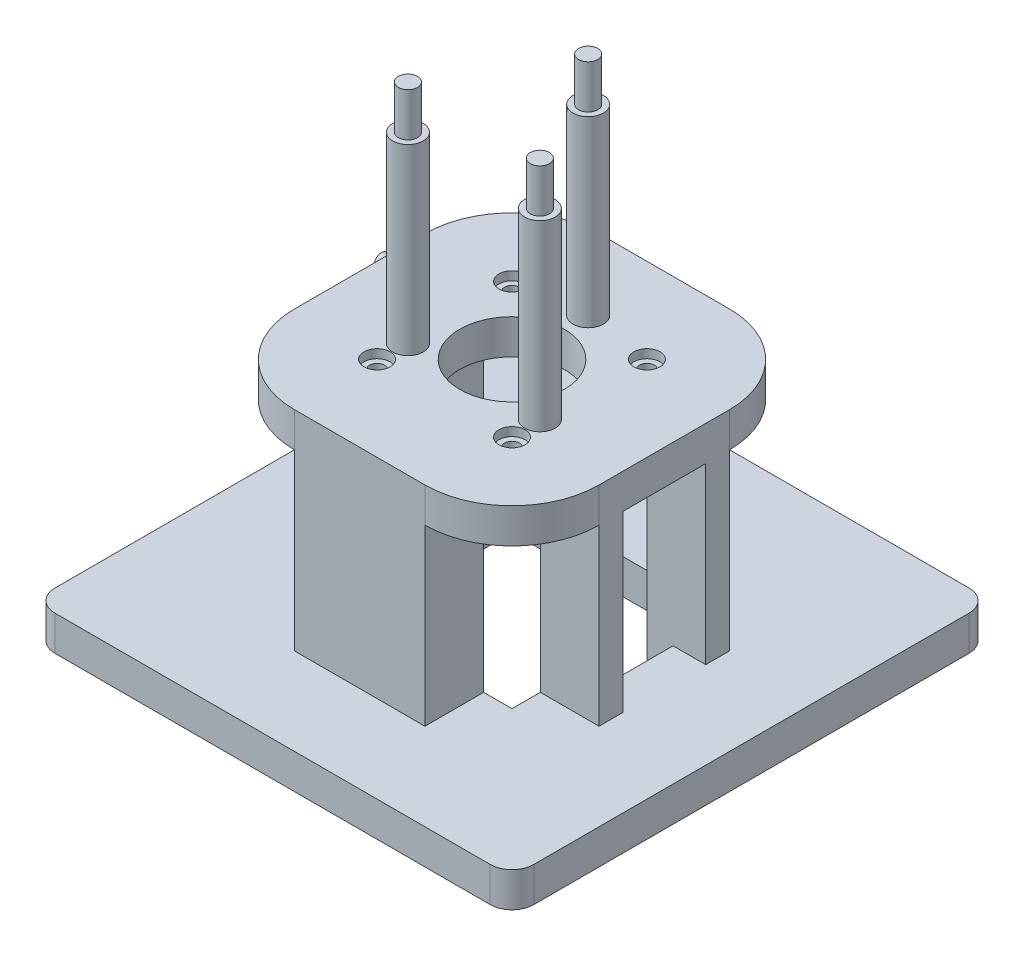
SolidWorks part; units mm, degrees
ref_plane "前视基准面" through (0, 0, 0) normal (0, 0, 1) x (1, 0, 0)
ref_plane "上视基准面" through (0, 0, 0) normal (0, 1, 0) x (1, 0, 0)
ref_plane "右视基准面" through (0, 0, 0) normal (1, 0, 0) x (0, 0, -1)
sketch "草图3" plane through (0, 0, 0) normal (0, 1, 0) x (1, 0, 0)
  line L0 (15.5, 15.5) -> (15.5, -15.5)
  line L1 (-15, 25) -> (15, 25)
  line L2 (-25, 15) -> (-25, -15)
  line L3 (-15, -25) -> (15, -25)
  line L4 (25, 15) -> (25, -15)
  line L5 (-25, 25) -> (25, -25) construction
  line L6 (-25, -25) -> (25, 25) construction
  line L7 (-15.5, -15.5) -> (15.5, -15.5)
  line L8 (-15.5, 15.5) -> (-15.5, -15.5)
  line L9 (-15.5, 15.5) -> (15.5, 15.5)
  line L10 (-25, 25) -> (25, 25) construction
  line L11 (25, 25) -> (25, -25) construction
  line L12 (-25, -25) -> (25, -25) construction
  line L13 (-25, 25) -> (-25, -25) construction
  line L14 (-35, 15) -> (-35, -15)
  line L15 (-15, -35) -> (15, -35)
  line L16 (35, 15) -> (35, -15)
  line L17 (-15, 35) -> (15, 35)
  arc A0 (15, 25) -> (25, 15) centre (15, 15) cw
  arc A1 (25, -15) -> (15, -25) centre (15, -15) cw
  arc A2 (-25, -15) -> (-15, -25) centre (-15, -15) ccw
  arc A3 (-15, 25) -> (-25, 15) centre (-15, 15) ccw
  arc A4 (-15, 35) -> (-35, 15) centre (-15, 15) ccw
  arc A5 (-35, -15) -> (-15, -35) centre (-15, -15) ccw
  arc A6 (35, -15) -> (15, -35) centre (15, -15) cw
  arc A7 (15, 35) -> (35, 15) centre (15, 15) cw
  point P1 (0, 0)
  dimension "D4" = 10
  dimension "D1" = 50
  dimension "D2" = 50
  dimension "D3" = 9.5
  dimension "D5" = 10
extrude "凸台-拉伸2" add sketch "草图3" against normal blind 8 contours A7 L17 A4 L14 A5 L15 A6 L16 A3 L1 A0 L4 A1 L3 A2 L2 | L1 A3 L2 A2 L3 A1 L4 A0 L8 L9 L0 L7 | L9 L8 L7 L0
sketch "草图10" plane through (0, 0, 0) normal (0, 1, 0) x (1, 0, 0)
  circle A0 centre (0, 0) radius 12
  dimension "D1" = 24
extrude "切除-拉伸1" cut sketch "草图10" against normal through all
sketch "草图11" plane through (0, 0, 0) normal (0, 1, 0) x (1, 0, 0)
  line L1 (-15.5, 15.5) -> (15.5, 15.5)
  line L2 (-15.5, 15.5) -> (-15.5, -15.5)
  line L3 (-15.5, -15.5) -> (15.5, -15.5)
  line L4 (15.5, 15.5) -> (15.5, -15.5)
  line L5 (-15.5, 15.5) -> (15.5, -15.5) construction
  line L6 (-15.5, -15.5) -> (15.5, 15.5) construction
  point P0 (0, 0)
  dimension "D1" = 31
  dimension "D2" = 31
sketch "草图14" plane through (0, 0, 0) normal (0, 1, 0) x (1, 0, 0)
sketch "草图16" plane through (0, 0, 0) normal (0, 1, 0) x (1, 0, 0)
  point P0 (-15.5, 15.5)
  point P3 (15.5, 15.5)
  point P6 (15.5, -15.5)
  point P9 (-15.5, -15.5)
hole_wizard "M3 开槽圆柱头螺钉的柱形沉头孔1" positions "草图16" profile "草图17" counterbore size "M3" standard "GB"
sketch "草图17" plane through (-15.5, 0, -15.5) normal (1, 0, 0) x (0, 0, 1)
  line L0 (0, 0) -> (0, 8)
  line L1 (0, 8) -> (1.7, 8)
  line L3 (1.7, 8) -> (1.7, 2)
  line L4 (1.7, 2) -> (3, 2)
  line L5 (3, 2) -> (3, 0)
  line L7 (3, 0) -> (0, 0)
  line L11 (0, -6.35) -> (0, 107.95) construction
  dimension "通孔孔直径" = 3.4
  dimension "通孔孔深度" = 8
  dimension "柱形沉头孔直径" = 6
  dimension "柱形沉头孔深度" = 2
sketch "草图18" plane through (0, -8, 0) normal (0, -1, 0) x (1, 0, 0)
  line L0 (0, 0) -> (-63.324, 0) construction
  line L2 (-21.5, 15) -> (-21.5, -15)
  line L7 (-35, -15) -> (-21.5, -15)
  line L8 (-35, 15) -> (-21.5, 15)
  line L9 (-35, 15) -> (-35, -15)
  point P0 (0, 0)
  dimension "D1" = 30
  dimension "D2" = 21.5
extrude "凸台-拉伸3" add sketch "草图18" along normal blind 40
sketch "草图27" plane through (0, -8, 0) normal (0, -1, 0) x (1, 0, 0)
  line L0 (-15, 35) -> (-15, 21.5)
  line L1 (15, 21.5) -> (-15, 21.5)
  line L2 (21.5, 15) -> (21.5, 9.5)
  line L5 (35, -9.5) -> (21.5, -9.5)
  line L6 (35, 9.5) -> (21.5, 9.5)
  line L7 (15, 35) -> (15, 21.5)
  line L8 (-15, 35) -> (15, 35)
  line L9 (35, 15) -> (21.5, 15)
  line L10 (35, -15) -> (21.5, -15)
  line L11 (35, -15) -> (35, -9.5)
  line L12 (35, 9.5) -> (35, 15)
  line L13 (21.5, -9.5) -> (21.5, -15)
  point P0 (0, 0)
  dimension "D1" = 5.5
  dimension "D2" = 21.5
  dimension "D4" = 21.5
  dimension "D3" = 5.5
extrude "凸台-拉伸6" add sketch "草图27" along normal up to surface (40 mm away)
sketch "草图29" plane through (0, -48, 0) normal (0, -1, 0) x (1, 0, 0)
  line L1 (-55, 55) -> (55, 55)
  line L2 (-55, 55) -> (-55, -55)
  line L3 (-55, -55) -> (55, -55)
  line L4 (55, 55) -> (55, -55)
  line L5 (-55, 55) -> (55, -55) construction
  line L6 (-55, -55) -> (55, 55) construction
  point P0 (0, 0)
  dimension "D1" = 110
  dimension "D2" = 110
extrude "凸台-拉伸7" add sketch "草图29" along normal blind 8
fillet "圆角4" radius 5 4 edges at (-55, -52, 55) (-55, -52, -55) (55, -52, -55) (55, -52, 55)
sketch "草图30" plane through (0, -56, 0) normal (0, -1, 0) x (1, 0, 0)
  line L1 (-21.5, 21.5) -> (21.5, 21.5)
  line L2 (-21.5, 21.5) -> (-21.5, -21.5)
  line L3 (-21.5, -21.5) -> (21.5, -21.5)
  line L4 (21.5, 21.5) -> (21.5, -21.5)
  line L5 (-21.5, 21.5) -> (21.5, -21.5) construction
  line L6 (-21.5, -21.5) -> (21.5, 21.5) construction
  point P0 (0, 0)
  dimension "D1" = 43
  dimension "D2" = 43
extrude "切除-拉伸4" cut sketch "草图30" against normal blind 8
sketch "草图32" plane through (0, -48, 0) normal (0, 1, 0) x (1, 0, 0)
  line L0 (21.5, 9.5) -> (21.5, -9.5)
  line L1 (21.5, -9.5) -> (27.5, -9.5)
  line L2 (21.5, -9.5) -> (35, -9.5) construction
  line L3 (27.5, -9.5) -> (27.5, 9.5)
  line L4 (35, 9.5) -> (21.5, 9.5) construction
  line L5 (27.5, 9.5) -> (21.5, 9.5)
  dimension "D1" = 6
extrude "切除-拉伸5" cut sketch "草图32" against normal up to next
sketch "草图36" plane through (0, 0, 0) normal (0, 1, 0) x (1, 0, 0)
  line L0 (0, 0) -> (0, 17.5) construction
  circle A1 centre (0, 17.5) radius 3.5
  circle A2 centre (15.1554, -8.75) radius 3.5
  circle A3 centre (-15.1554, -8.75) radius 3.5
  circle A4 centre (0, 0) radius 17.5 construction
  point P12 (0, 0)
  dimension "D1" = 35
  dimension "D2" = 7
  dimension "D3" = 3
extrude "凸台-拉伸8" add sketch "草图36" along normal blind 42
sketch "草图37" plane through (0, 42, 0) normal (0, 1, 0) x (1, 0, 0)
  circle A0 centre (0, 0) radius 17.5 construction
  circle A1 centre (0, 17.5) radius 2.2002
  circle A2 centre (15.1554, -8.75) radius 2.2002
  circle A3 centre (-15.1554, -8.75) radius 2.2002
  point P13 (0, 0)
  dimension "D1" = 4.4005
  dimension "D2" = 3
extrude "凸台-拉伸9" add sketch "草图37" along normal blind 10
sketch "草图39" plane through (-35, 0, 0) normal (-1, 0, 0) x (0, 0, 1)
  line L0 (-10, 0) -> (-10, -48) construction
  line L1 (-15, 0) -> (15, 0) construction
  line L2 (15, -48) -> (-15, -48) construction
  line L3 (-15, -48) -> (-15, -8) construction
  circle A0 centre (-10, -5.4569) radius 1.7
  circle A1 centre (-10, -41.4569) radius 1.7
  dimension "D2" = 3.4
  dimension "D1" = 5
  dimension "D3" = 5.4569
  dimension "D4" = 2
extrude "凸台-拉伸10" add sketch "草图39" along normal blind 5
